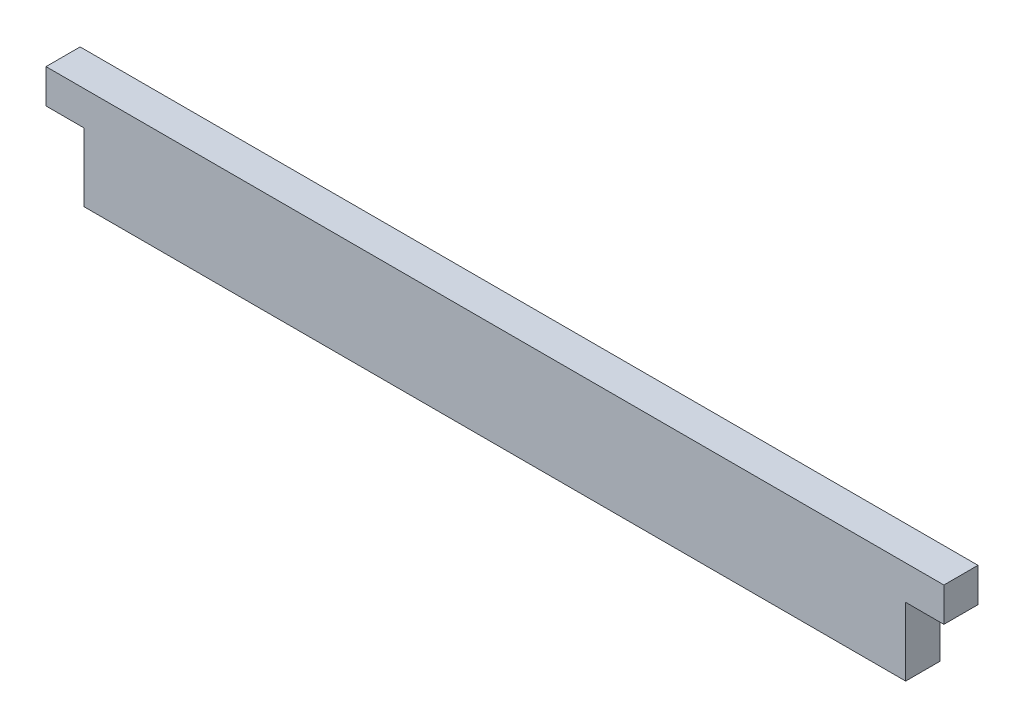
SolidWorks part; units mm, degrees
ref_plane "Front Plane" through (0, 0, 0) normal (0, 0, 1) x (1, 0, 0)
ref_plane "Top Plane" through (0, 0, 0) normal (0, 1, 0) x (1, 0, 0)
ref_plane "Right Plane" through (0, 0, 0) normal (1, 0, 0) x (0, 0, -1)
sketch "Sketch1" plane through (0, 0, 0) normal (0, 0, -1) x (1, 0, 0)
  line L0 (41.783, 0) -> (41.783, 12.5333) construction
  line L1 (0, 0) -> (83.566, 0)
  line L3 (0, -9.525) -> (83.566, -9.525)
  line L5 (0, 0) -> (0, -3.175)
  line L6 (0, -3.175) -> (3.556, -3.175)
  line L7 (3.556, -3.175) -> (3.556, -6.35)
  line L8 (3.556, -6.35) -> (0, -6.35)
  line L9 (0, -6.35) -> (0, -9.525)
  line L10 (83.566, -6.35) -> (83.566, -9.525)
  line L11 (80.01, -6.35) -> (83.566, -6.35)
  line L12 (80.01, -3.175) -> (80.01, -6.35)
  line L13 (83.566, -3.175) -> (80.01, -3.175)
  line L14 (83.566, 0) -> (83.566, -3.175)
  line L15 (3.556, -3.175) -> (3.556, 0)
  line L16 (80.01, -3.175) -> (80.01, 0)
  dimension "D1" = 83.566
  dimension "D2" = 3.175
  dimension "D3" = 3.556
extrude "Boss-Extrude1" add sketch "Sketch1" along normal blind 3.175 contours L16 L12 L11 L10 L3 L9 L8 L7 L15 L1
